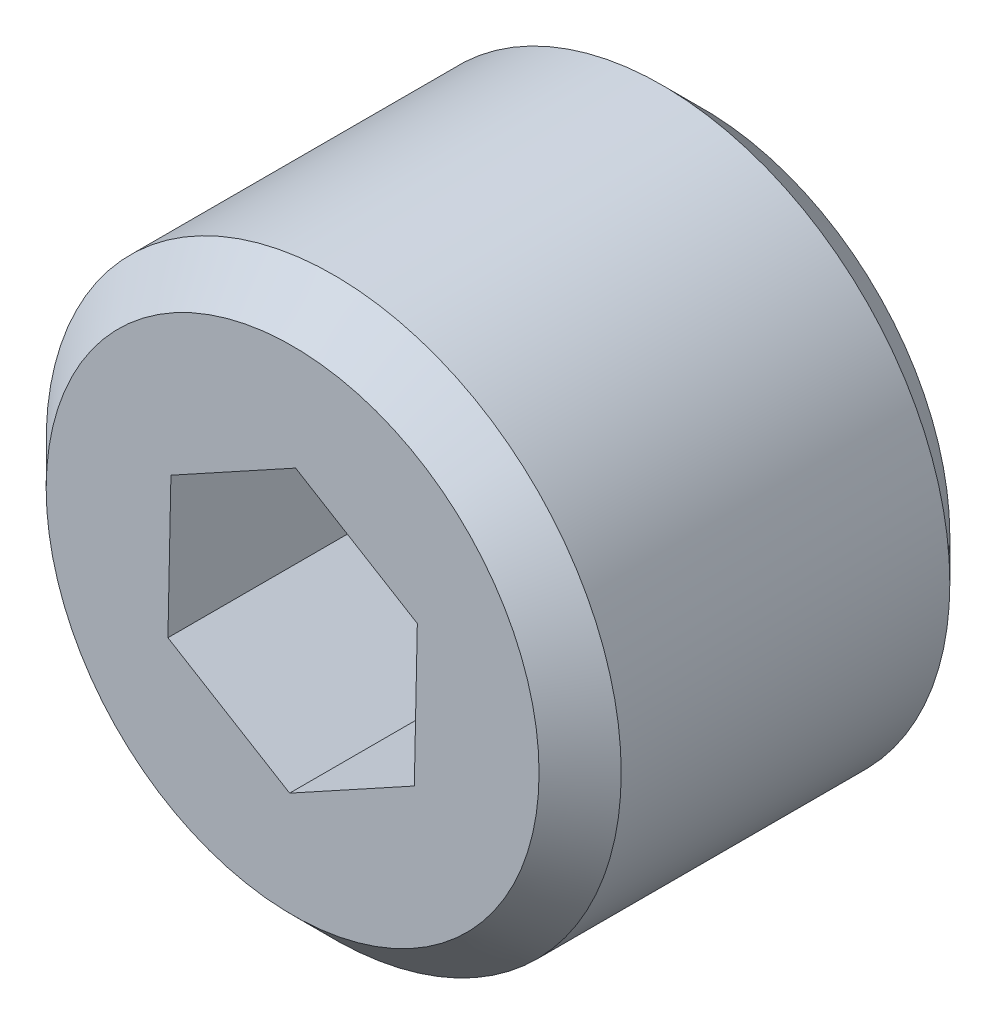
SolidWorks part; units mm, degrees
ref_plane "Alzado" through (0, 0, 0) normal (0, 0, 1) x (1, 0, 0)
ref_plane "Planta" through (0, 0, 0) normal (0, 1, 0) x (1, 0, 0)
ref_plane "Vista lateral" through (0, 0, 0) normal (1, 0, 0) x (0, 0, -1)
sketch "Croquis1" plane through (0, 0, 0) normal (0, 0, 1) x (1, 0, 0)
  circle A0 centre (0, 0) radius 7
  dimension "D1" = 14
extrude "Saliente-Extruir1" add sketch "Croquis1" along normal blind 10
sketch "Croquis2" plane through (0, 0, 10) normal (0, 0, 1) x (1, 0, 0)
  line L1 (-2.9628, 1.795) -> (-3.0359, -1.6683)
  line L2 (-3.0359, -1.6683) -> (-0.0731, -3.4633)
  line L3 (-0.0731, -3.4633) -> (2.9628, -1.795)
  line L4 (2.9628, -1.795) -> (3.0359, 1.6683)
  line L5 (3.0359, 1.6683) -> (0.0731, 3.4633)
  line L6 (0.0731, 3.4633) -> (-2.9628, 1.795)
  circle A0 centre (0, 0) radius 3 construction
  dimension "D1" = 6
extrude "Cortar-Extruir1" cut sketch "Croquis2" against normal blind 5
chamfer "Chaflán1" distance 1 angle 45 2 edges at (7, 0, 0) (7, 0, 10)
